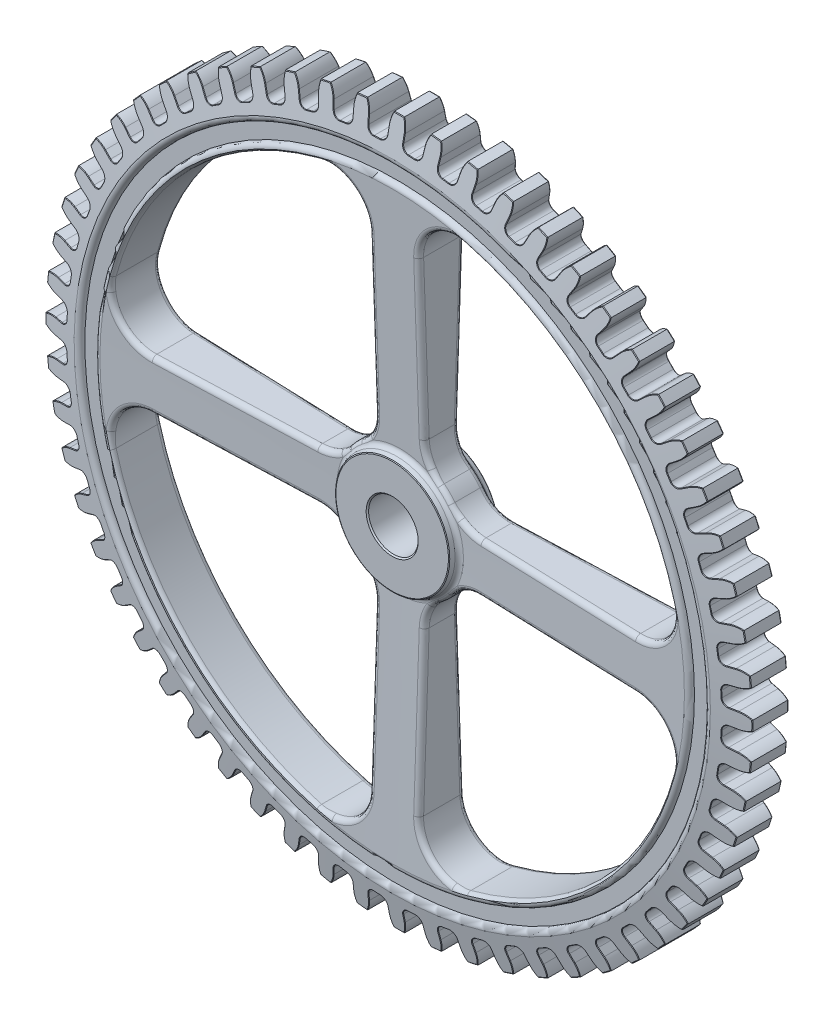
SolidWorks part; units mm, degrees
ref_plane "Спереди" through (0, 0, 0) normal (0, 0, 1) x (1, 0, 0)
ref_plane "Сверху" through (0, 0, 0) normal (0, 1, 0) x (1, 0, 0)
ref_plane "Справа" through (0, 0, 0) normal (1, 0, 0) x (0, 0, -1)
sketch "Эскиз2" plane through (0, 0, 0) normal (1, 0, 0) x (0, 0, -1)
  line L0 (-9.4803, 0) -> (8.8412, 0) construction
  line L1 (5, 5) -> (-5, 5)
  line L2 (5, 5) -> (5, 11.5)
  line L3 (3.6, 71.3) -> (-3.6, 71.3)
  line L4 (0, 0) -> (0, 71.3) construction
  line L5 (4, 63) -> (4, 60)
  line L6 (5, 11.5) -> (5, 38.75) construction
  line L7 (3.6, 71.3) -> (4.9816, 64.1908)
  line L8 (5, 11.5) -> (4.0932, 11.7772)
  line L9 (4.9994, 58.9651) -> (3.3862, 12.7684)
  line L10 (-5, 5) -> (-5, 11.5)
  line L11 (-5, 11.5) -> (-4.0932, 11.7772)
  line L12 (-4.9994, 58.9651) -> (-3.3862, 12.7684)
  line L13 (-4, 63) -> (-4, 60)
  line L14 (-3.6, 71.3) -> (-4.9816, 64.1908)
  arc A0 (4, 63) -> (4.9816, 64.1908) centre (4, 64) ccw
  arc A1 (4.9994, 58.9651) -> (4, 60) centre (4, 59) ccw
  arc A2 (3.3862, 12.7684) -> (4.0932, 11.7772) centre (4.3856, 12.7335) ccw
  arc A3 (-3.3862, 12.7684) -> (-4.0932, 11.7772) centre (-4.3856, 12.7335) cw
  arc A4 (-4.9994, 58.9651) -> (-4, 60) centre (-4, 59) cw
  arc A5 (-4, 63) -> (-4.9816, 64.1908) centre (-4, 64) cw
  point P19 (0, 5)
  dimension "D8" = 2
  dimension "D1" = 8.3
  dimension "D2" = 71.3
  dimension "D3" = 5
  dimension "D4" = 5
  dimension "D5" = 3.6
  dimension "D6" = 3
  dimension "D7" = 11.5
  dimension "D9" = 4
  dimension "D10" = 17
  dimension "D11" = 2
revolve "Повернуть1" add sketch "Эскиз2" angle 360 about L0
sketch "Эскиз4" plane through (0, 0, 0) normal (0, 0, 1) x (1, 0, 0)
  line L0 (0, 77.9843) -> (0, -81.6368) construction
  line L1 (-86.0797, 0) -> (81.9993, 0) construction
  line L2 (5, 48.7981) -> (5, 16.4924)
  line L3 (16.4924, 5) -> (48.7981, 5)
  line L4 (48.7981, -5) -> (16.4924, -5)
  line L5 (5, -16.4924) -> (5, -48.7981)
  line L6 (-5, -48.7981) -> (-5, -16.4924)
  line L7 (-16.4924, -5) -> (-48.7981, -5)
  line L8 (-48.7981, 5) -> (-16.4924, 5)
  line L9 (-5, 16.4924) -> (-5, 48.7981)
  arc A0 (10.2096, 8.0476) -> (8.0476, 10.2096) centre (0, 0) ccw
  arc A1 (56.5284, 15.0594) -> (15.0594, 56.5284) centre (0, 0) ccw
  arc A2 (15.0594, 56.5284) -> (5, 48.7981) centre (13, 48.7981) ccw
  arc A3 (48.7981, 5) -> (56.5284, 15.0594) centre (48.7981, 13) ccw
  arc A4 (5, 16.4924) -> (8.0476, 10.2096) centre (13, 16.4924) ccw
  arc A5 (10.2096, 8.0476) -> (16.4924, 5) centre (16.4924, 13) ccw
  arc A6 (8.0476, -10.2096) -> (10.2096, -8.0476) centre (0, 0) ccw
  arc A7 (15.0594, -56.5284) -> (56.5284, -15.0594) centre (0, 0) ccw
  arc A8 (56.5284, -15.0594) -> (48.7981, -5) centre (48.7981, -13) ccw
  arc A9 (5, -48.7981) -> (15.0594, -56.5284) centre (13, -48.7981) ccw
  arc A10 (16.4924, -5) -> (10.2096, -8.0476) centre (16.4924, -13) ccw
  arc A11 (8.0476, -10.2096) -> (5, -16.4924) centre (13, -16.4924) ccw
  arc A12 (-10.2096, -8.0476) -> (-8.0476, -10.2096) centre (0, 0) ccw
  arc A13 (-56.5284, -15.0594) -> (-15.0594, -56.5284) centre (0, 0) ccw
  arc A14 (-15.0594, -56.5284) -> (-5, -48.7981) centre (-13, -48.7981) ccw
  arc A15 (-48.7981, -5) -> (-56.5284, -15.0594) centre (-48.7981, -13) ccw
  arc A16 (-5, -16.4924) -> (-8.0476, -10.2096) centre (-13, -16.4924) ccw
  arc A17 (-10.2096, -8.0476) -> (-16.4924, -5) centre (-16.4924, -13) ccw
  arc A18 (-8.0476, 10.2096) -> (-10.2096, 8.0476) centre (0, 0) ccw
  arc A19 (-15.0594, 56.5284) -> (-56.5284, 15.0594) centre (0, 0) ccw
  arc A20 (-56.5284, 15.0594) -> (-48.7981, 5) centre (-48.7981, 13) ccw
  arc A21 (-5, 48.7981) -> (-15.0594, 56.5284) centre (-13, 48.7981) ccw
  arc A22 (-16.4924, 5) -> (-10.2096, 8.0476) centre (-16.4924, 13) ccw
  arc A23 (-8.0476, 10.2096) -> (-5, 16.4924) centre (-13, 16.4924) ccw
  dimension "D3" = 26
  dimension "D4" = 117
  dimension "D5" = 16
  dimension "D1" = 5
  dimension "D2" = 5
  dimension "D7" = 10
  dimension "D6" = 4
extrude "Вырез-Вытянуть1" cut sketch "Эскиз4" against normal mid plane 10
fillet "Скругление1" radius 1 56 edges at (12.2001, 6.249, -3.419) (9.1924, 9.1924, -3.3943) (5.4509, 13.8447, -3.4599) (7.5393, 54.6445, -4.8666) (55.5841, 8.7633, -4.9053) (54.6445, -7.5393, -4.8666) (8.7633, -55.5841, -4.9053) (6.249, -12.2001, -3.419) (9.1924, -9.1924, -3.3943) (13.8447, -5.4509, -3.4599) (-12.2001, -6.249, -3.419) (-9.1924, -9.1924, -3.3943) (-5.4509, -13.8447, -3.4599) (-7.5393, -54.6445, -4.8666) (-55.5841, -8.7633, -4.9053) (-54.6445, 7.5393, -4.8666) (-8.7633, 55.5841, -4.9053) (-6.249, 12.2001, -3.419) (-9.1924, 9.1924, -3.3943) (-13.8447, 5.4509, -3.4599) (7.5393, -54.6445, 4.8666) (55.5841, -8.7633, 4.9053) (12.2001, -6.249, 3.419) (9.1924, -9.1924, 3.3943) (5.4509, -13.8447, 3.4599) (-54.6445, -7.5393, 4.8666) (-8.7633, -55.5841, 4.9053) (-6.249, -12.2001, 3.419) (-9.1924, -9.1924, 3.3943) (-13.8447, -5.4509, 3.4599) (-7.5393, 54.6445, 4.8666) (-55.5841, 8.7633, 4.9053) (-12.2001, 6.249, 3.419) (-9.1924, 9.1924, 3.3943) (-5.4509, 13.8447, 3.4599) (6.249, 12.2001, 3.419) (9.1924, 9.1924, 3.3943) (13.8447, 5.4509, 3.4599) (54.6445, 7.5393, 4.8666) (8.7633, 55.5841, 4.9053)
sketch "Эскиз5" plane through (0, 0, 0) normal (0, 0, 1) x (1, 0, 0)
  line L0 (0, 93.6984) -> (0, 0) construction
  line L1 (0, 0) -> (3.6112, 68.9054) construction
  line L2 (-1.6, 68.9054) -> (-1.6, 67.3339)
  line L3 (1.6, 68.9054) -> (1.6, 67.3339)
  line L4 (5.6113, 68.6952) -> (5.4471, 67.1322)
  line L5 (8.7938, 68.3607) -> (8.6295, 66.7978)
  line L6 (12.7612, 67.7323) -> (12.4345, 66.1951)
  line L7 (15.8913, 67.067) -> (15.5645, 65.5298)
  line L8 (19.7713, 66.0274) -> (19.2856, 64.5327)
  line L9 (22.8146, 65.0385) -> (22.329, 63.5439)
  line L10 (26.5647, 63.599) -> (25.9255, 62.1633)
  line L11 (29.488, 62.2975) -> (28.8488, 60.8618)
  line L12 (33.0671, 60.4739) -> (32.2813, 59.1128)
  line L13 (35.8384, 58.8739) -> (35.0526, 57.5128)
  line L14 (39.2072, 56.6861) -> (38.2834, 55.4147)
  line L15 (41.796, 54.8052) -> (40.8723, 53.5338)
  line L16 (44.9177, 52.2773) -> (43.8661, 51.1094)
  line L17 (47.2958, 50.1361) -> (46.2442, 48.9682)
  line L18 (50.1361, 47.2958) -> (48.9682, 46.2442)
  line L19 (52.2773, 44.9177) -> (51.1094, 43.8661)
  line L20 (54.8052, 41.796) -> (53.5338, 40.8723)
  line L21 (56.6861, 39.2072) -> (55.4147, 38.2834)
  line L22 (58.8739, 35.8384) -> (57.5128, 35.0526)
  line L23 (60.4739, 33.0671) -> (59.1128, 32.2813)
  line L24 (62.2975, 29.488) -> (60.8618, 28.8488)
  line L25 (63.599, 26.5647) -> (62.1633, 25.9255)
  line L26 (65.0385, 22.8146) -> (63.5439, 22.329)
  line L27 (66.0274, 19.7713) -> (64.5327, 19.2856)
  line L28 (67.067, 15.8913) -> (65.5298, 15.5645)
  line L29 (67.7323, 12.7612) -> (66.1951, 12.4345)
  line L30 (68.3607, 8.7938) -> (66.7978, 8.6295)
  line L31 (68.6952, 5.6113) -> (67.1322, 5.4471)
  line L32 (68.9054, 1.6) -> (67.3339, 1.6)
  line L33 (68.9054, -1.6) -> (67.3339, -1.6)
  line L34 (68.6952, -5.6113) -> (67.1322, -5.4471)
  line L35 (68.3607, -8.7938) -> (66.7978, -8.6295)
  line L36 (67.7323, -12.7612) -> (66.1951, -12.4345)
  line L37 (67.067, -15.8913) -> (65.5298, -15.5645)
  line L38 (66.0274, -19.7713) -> (64.5327, -19.2856)
  line L39 (65.0385, -22.8146) -> (63.5439, -22.329)
  line L40 (63.599, -26.5647) -> (62.1633, -25.9255)
  line L41 (62.2975, -29.488) -> (60.8618, -28.8488)
  line L42 (60.4739, -33.0671) -> (59.1128, -32.2813)
  line L43 (58.8739, -35.8384) -> (57.5128, -35.0526)
  line L44 (56.6861, -39.2072) -> (55.4147, -38.2834)
  line L45 (54.8052, -41.796) -> (53.5338, -40.8723)
  line L46 (52.2773, -44.9177) -> (51.1094, -43.8661)
  line L47 (50.1361, -47.2958) -> (48.9682, -46.2442)
  line L48 (47.2958, -50.1361) -> (46.2442, -48.9682)
  line L49 (44.9177, -52.2773) -> (43.8661, -51.1094)
  line L50 (41.796, -54.8052) -> (40.8723, -53.5338)
  line L51 (39.2072, -56.6861) -> (38.2834, -55.4147)
  line L52 (35.8384, -58.8739) -> (35.0526, -57.5128)
  line L53 (33.0671, -60.4739) -> (32.2813, -59.1128)
  line L54 (29.488, -62.2975) -> (28.8488, -60.8618)
  line L55 (26.5647, -63.599) -> (25.9255, -62.1633)
  line L56 (22.8146, -65.0385) -> (22.329, -63.5439)
  line L57 (19.7713, -66.0274) -> (19.2856, -64.5327)
  line L58 (15.8913, -67.067) -> (15.5645, -65.5298)
  line L59 (12.7612, -67.7323) -> (12.4345, -66.1951)
  line L60 (8.7938, -68.3607) -> (8.6295, -66.7978)
  line L61 (5.6113, -68.6952) -> (5.4471, -67.1322)
  line L62 (1.6, -68.9054) -> (1.6, -67.3339)
  line L63 (-1.6, -68.9054) -> (-1.6, -67.3339)
  line L64 (-5.6113, -68.6952) -> (-5.4471, -67.1322)
  line L65 (-8.7938, -68.3607) -> (-8.6295, -66.7978)
  line L66 (-12.7612, -67.7323) -> (-12.4345, -66.1951)
  line L67 (-15.8913, -67.067) -> (-15.5645, -65.5298)
  line L68 (-19.7713, -66.0274) -> (-19.2856, -64.5327)
  line L69 (-22.8146, -65.0385) -> (-22.329, -63.5439)
  line L70 (-26.5647, -63.599) -> (-25.9255, -62.1633)
  line L71 (-29.488, -62.2975) -> (-28.8488, -60.8618)
  line L72 (-33.0671, -60.4739) -> (-32.2813, -59.1128)
  line L73 (-35.8384, -58.8739) -> (-35.0526, -57.5128)
  line L74 (-39.2072, -56.6861) -> (-38.2834, -55.4147)
  line L75 (-41.796, -54.8052) -> (-40.8723, -53.5338)
  line L76 (-44.9177, -52.2773) -> (-43.8661, -51.1094)
  line L77 (-47.2958, -50.1361) -> (-46.2442, -48.9682)
  line L78 (-50.1361, -47.2958) -> (-48.9682, -46.2442)
  line L79 (-52.2773, -44.9177) -> (-51.1094, -43.8661)
  line L80 (-54.8052, -41.796) -> (-53.5338, -40.8723)
  line L81 (-56.6861, -39.2072) -> (-55.4147, -38.2834)
  line L82 (-58.8739, -35.8384) -> (-57.5128, -35.0526)
  line L83 (-60.4739, -33.0671) -> (-59.1128, -32.2813)
  line L84 (-62.2975, -29.488) -> (-60.8618, -28.8488)
  line L85 (-63.599, -26.5647) -> (-62.1633, -25.9255)
  line L86 (-65.0385, -22.8146) -> (-63.5439, -22.329)
  line L87 (-66.0274, -19.7713) -> (-64.5327, -19.2856)
  line L88 (-67.067, -15.8913) -> (-65.5298, -15.5645)
  line L89 (-67.7323, -12.7612) -> (-66.1951, -12.4345)
  line L90 (-68.3607, -8.7938) -> (-66.7978, -8.6295)
  line L91 (-68.6952, -5.6113) -> (-67.1322, -5.4471)
  line L92 (-68.9054, -1.6) -> (-67.3339, -1.6)
  line L93 (-68.9054, 1.6) -> (-67.3339, 1.6)
  line L94 (-68.6952, 5.6113) -> (-67.1322, 5.4471)
  line L95 (-68.3607, 8.7938) -> (-66.7978, 8.6295)
  line L96 (-67.7323, 12.7612) -> (-66.1951, 12.4345)
  line L97 (-67.067, 15.8913) -> (-65.5298, 15.5645)
  line L98 (-66.0274, 19.7713) -> (-64.5327, 19.2856)
  line L99 (-65.0385, 22.8146) -> (-63.5439, 22.329)
  line L100 (-63.599, 26.5647) -> (-62.1633, 25.9255)
  line L101 (-62.2975, 29.488) -> (-60.8618, 28.8488)
  line L102 (-60.4739, 33.0671) -> (-59.1128, 32.2813)
  line L103 (-58.8739, 35.8384) -> (-57.5128, 35.0526)
  line L104 (-56.6861, 39.2072) -> (-55.4147, 38.2834)
  line L105 (-54.8052, 41.796) -> (-53.5338, 40.8723)
  line L106 (-52.2773, 44.9177) -> (-51.1094, 43.8661)
  line L107 (-50.1361, 47.2958) -> (-48.9682, 46.2442)
  line L108 (-47.2958, 50.1361) -> (-46.2442, 48.9682)
  line L109 (-44.9177, 52.2773) -> (-43.8661, 51.1094)
  line L110 (-41.796, 54.8052) -> (-40.8723, 53.5338)
  line L111 (-39.2072, 56.6861) -> (-38.2834, 55.4147)
  line L112 (-35.8384, 58.8739) -> (-35.0526, 57.5128)
  line L113 (-33.0671, 60.4739) -> (-32.2813, 59.1128)
  line L114 (-29.488, 62.2975) -> (-28.8488, 60.8618)
  line L115 (-26.5647, 63.599) -> (-25.9255, 62.1633)
  line L116 (-22.8146, 65.0385) -> (-22.329, 63.5439)
  line L117 (-19.7713, 66.0274) -> (-19.2856, 64.5327)
  line L118 (-15.8913, 67.067) -> (-15.5645, 65.5298)
  line L119 (-12.7612, 67.7323) -> (-12.4345, 66.1951)
  line L120 (-8.7938, 68.3607) -> (-8.6295, 66.7978)
  line L121 (-5.6113, 68.6952) -> (-5.4471, 67.1322)
  circle A0 centre (0, 0) radius 69 construction
  arc A1 (-9.7062, 65.4088) -> (-10.9813, 65.2068) centre (0, 0) ccw
  arc A2 (-1.021, 71.2927) -> (-1.6, 68.9054) centre (3.6112, 68.9054) ccw
  circle A3 centre (0, 0) radius 71.3 construction
  arc A4 (1.021, 71.2927) -> (-1.021, 71.2927) centre (0, 0) ccw
  arc A5 (1.021, 71.2927) -> (1.6, 68.9054) centre (-3.6112, 68.9054) cw
  arc A6 (6.4367, 71.0089) -> (5.6113, 68.6952) centre (10.794, 68.1505) ccw
  arc A7 (8.4676, 70.7954) -> (6.4367, 71.0089) centre (0, 0) ccw
  arc A8 (8.4676, 70.7954) -> (8.7938, 68.3607) centre (3.6112, 68.9054) cw
  arc A9 (13.8239, 69.9471) -> (12.7612, 67.7323) centre (17.8585, 66.6489) ccw
  arc A10 (15.8213, 69.5225) -> (13.8239, 69.9471) centre (0, 0) ccw
  arc A11 (15.8213, 69.5225) -> (15.8913, 67.067) centre (10.794, 68.1505) cw
  arc A12 (21.0596, 68.1189) -> (19.7713, 66.0274) centre (24.7274, 64.417) ccw
  arc A13 (23.0017, 67.4879) -> (21.0596, 68.1189) centre (0, 0) ccw
  arc A14 (23.0017, 67.4879) -> (22.8146, 65.0385) centre (17.8585, 66.6489) cw
  arc A15 (28.0646, 65.5444) -> (26.5647, 63.599) centre (31.3253, 61.4795) ccw
  arc A16 (29.9301, 64.7138) -> (28.0646, 65.5444) centre (0, 0) ccw
  arc A17 (29.9301, 64.7138) -> (29.488, 62.2975) centre (24.7274, 64.417) cw
  arc A18 (34.7621, 62.2518) -> (33.0671, 60.4739) centre (37.5801, 57.8683) ccw
  arc A19 (36.5306, 61.2308) -> (34.7621, 62.2518) centre (0, 0) ccw
  arc A20 (36.5306, 61.2308) -> (35.8384, 58.8739) centre (31.3253, 61.4795) cw
  arc A21 (41.0788, 58.2771) -> (39.2072, 56.6861) centre (43.4231, 53.6231) ccw
  arc A22 (42.7308, 57.0768) -> (41.0788, 58.2771) centre (0, 0) ccw
  arc A23 (42.7308, 57.0768) -> (41.796, 54.8052) centre (37.5801, 57.8683) cw
  arc A24 (46.9453, 53.664) -> (44.9177, 52.2773) centre (48.7904, 48.7904) ccw
  arc A25 (48.4629, 52.2976) -> (46.9453, 53.664) centre (0, 0) ccw
  arc A26 (48.4629, 52.2976) -> (47.2958, 50.1361) centre (43.4231, 53.6231) cw
  arc A27 (52.2976, 48.4629) -> (50.1361, 47.2958) centre (53.6231, 43.4231) ccw
  arc A28 (53.664, 46.9453) -> (52.2976, 48.4629) centre (0, 0) ccw
  arc A29 (53.664, 46.9453) -> (52.2773, 44.9177) centre (48.7904, 48.7904) cw
  arc A30 (57.0768, 42.7308) -> (54.8052, 41.796) centre (57.8683, 37.5801) ccw
  arc A31 (58.2771, 41.0788) -> (57.0768, 42.7308) centre (0, 0) ccw
  arc A32 (58.2771, 41.0788) -> (56.6861, 39.2072) centre (53.6231, 43.4231) cw
  arc A33 (61.2308, 36.5306) -> (58.8739, 35.8384) centre (61.4795, 31.3253) ccw
  arc A34 (62.2518, 34.7621) -> (61.2308, 36.5306) centre (0, 0) ccw
  arc A35 (62.2518, 34.7621) -> (60.4739, 33.0671) centre (57.8683, 37.5801) cw
  arc A36 (64.7138, 29.9301) -> (62.2975, 29.488) centre (64.417, 24.7274) ccw
  arc A37 (65.5444, 28.0646) -> (64.7138, 29.9301) centre (0, 0) ccw
  arc A38 (65.5444, 28.0646) -> (63.599, 26.5647) centre (61.4795, 31.3253) cw
  arc A39 (67.4879, 23.0017) -> (65.0385, 22.8146) centre (66.6489, 17.8585) ccw
  arc A40 (68.1189, 21.0596) -> (67.4879, 23.0017) centre (0, 0) ccw
  arc A41 (68.1189, 21.0596) -> (66.0274, 19.7713) centre (64.417, 24.7274) cw
  arc A42 (69.5225, 15.8213) -> (67.067, 15.8913) centre (68.1505, 10.794) ccw
  arc A43 (69.9471, 13.8239) -> (69.5225, 15.8213) centre (0, 0) ccw
  arc A44 (69.9471, 13.8239) -> (67.7323, 12.7612) centre (66.6489, 17.8585) cw
  arc A45 (70.7954, 8.4676) -> (68.3607, 8.7938) centre (68.9054, 3.6112) ccw
  arc A46 (71.0089, 6.4367) -> (70.7954, 8.4676) centre (0, 0) ccw
  arc A47 (71.0089, 6.4367) -> (68.6952, 5.6113) centre (68.1505, 10.794) cw
  arc A48 (71.2927, 1.021) -> (68.9054, 1.6) centre (68.9054, -3.6112) ccw
  arc A49 (71.2927, -1.021) -> (71.2927, 1.021) centre (0, 0) ccw
  arc A50 (71.2927, -1.021) -> (68.9054, -1.6) centre (68.9054, 3.6112) cw
  arc A51 (71.0089, -6.4367) -> (68.6952, -5.6113) centre (68.1505, -10.794) ccw
  arc A52 (70.7954, -8.4676) -> (71.0089, -6.4367) centre (0, 0) ccw
  arc A53 (70.7954, -8.4676) -> (68.3607, -8.7938) centre (68.9054, -3.6112) cw
  arc A54 (69.9471, -13.8239) -> (67.7323, -12.7612) centre (66.6489, -17.8585) ccw
  arc A55 (69.5225, -15.8213) -> (69.9471, -13.8239) centre (0, 0) ccw
  arc A56 (69.5225, -15.8213) -> (67.067, -15.8913) centre (68.1505, -10.794) cw
  arc A57 (68.1189, -21.0596) -> (66.0274, -19.7713) centre (64.417, -24.7274) ccw
  arc A58 (67.4879, -23.0017) -> (68.1189, -21.0596) centre (0, 0) ccw
  arc A59 (67.4879, -23.0017) -> (65.0385, -22.8146) centre (66.6489, -17.8585) cw
  arc A60 (65.5444, -28.0646) -> (63.599, -26.5647) centre (61.4795, -31.3253) ccw
  arc A61 (64.7138, -29.9301) -> (65.5444, -28.0646) centre (0, 0) ccw
  arc A62 (64.7138, -29.9301) -> (62.2975, -29.488) centre (64.417, -24.7274) cw
  arc A63 (62.2518, -34.7621) -> (60.4739, -33.0671) centre (57.8683, -37.5801) ccw
  arc A64 (61.2308, -36.5306) -> (62.2518, -34.7621) centre (0, 0) ccw
  arc A65 (61.2308, -36.5306) -> (58.8739, -35.8384) centre (61.4795, -31.3253) cw
  arc A66 (58.2771, -41.0788) -> (56.6861, -39.2072) centre (53.6231, -43.4231) ccw
  arc A67 (57.0768, -42.7308) -> (58.2771, -41.0788) centre (0, 0) ccw
  arc A68 (57.0768, -42.7308) -> (54.8052, -41.796) centre (57.8683, -37.5801) cw
  arc A69 (53.664, -46.9453) -> (52.2773, -44.9177) centre (48.7904, -48.7904) ccw
  arc A70 (52.2976, -48.4629) -> (53.664, -46.9453) centre (0, 0) ccw
  arc A71 (52.2976, -48.4629) -> (50.1361, -47.2958) centre (53.6231, -43.4231) cw
  arc A72 (48.4629, -52.2976) -> (47.2958, -50.1361) centre (43.4231, -53.6231) ccw
  arc A73 (46.9453, -53.664) -> (48.4629, -52.2976) centre (0, 0) ccw
  arc A74 (46.9453, -53.664) -> (44.9177, -52.2773) centre (48.7904, -48.7904) cw
  arc A75 (42.7308, -57.0768) -> (41.796, -54.8052) centre (37.5801, -57.8683) ccw
  arc A76 (41.0788, -58.2771) -> (42.7308, -57.0768) centre (0, 0) ccw
  arc A77 (41.0788, -58.2771) -> (39.2072, -56.6861) centre (43.4231, -53.6231) cw
  arc A78 (36.5306, -61.2308) -> (35.8384, -58.8739) centre (31.3253, -61.4795) ccw
  arc A79 (34.7621, -62.2518) -> (36.5306, -61.2308) centre (0, 0) ccw
  arc A80 (34.7621, -62.2518) -> (33.0671, -60.4739) centre (37.5801, -57.8683) cw
  arc A81 (29.9301, -64.7138) -> (29.488, -62.2975) centre (24.7274, -64.417) ccw
  arc A82 (28.0646, -65.5444) -> (29.9301, -64.7138) centre (0, 0) ccw
  arc A83 (28.0646, -65.5444) -> (26.5647, -63.599) centre (31.3253, -61.4795) cw
  arc A84 (23.0017, -67.4879) -> (22.8146, -65.0385) centre (17.8585, -66.6489) ccw
  arc A85 (21.0596, -68.1189) -> (23.0017, -67.4879) centre (0, 0) ccw
  arc A86 (21.0596, -68.1189) -> (19.7713, -66.0274) centre (24.7274, -64.417) cw
  arc A87 (15.8213, -69.5225) -> (15.8913, -67.067) centre (10.794, -68.1505) ccw
  arc A88 (13.8239, -69.9471) -> (15.8213, -69.5225) centre (0, 0) ccw
  arc A89 (13.8239, -69.9471) -> (12.7612, -67.7323) centre (17.8585, -66.6489) cw
  arc A90 (8.4676, -70.7954) -> (8.7938, -68.3607) centre (3.6112, -68.9054) ccw
  arc A91 (6.4367, -71.0089) -> (8.4676, -70.7954) centre (0, 0) ccw
  arc A92 (6.4367, -71.0089) -> (5.6113, -68.6952) centre (10.794, -68.1505) cw
  arc A93 (1.021, -71.2927) -> (1.6, -68.9054) centre (-3.6112, -68.9054) ccw
  arc A94 (-1.021, -71.2927) -> (1.021, -71.2927) centre (0, 0) ccw
  arc A95 (-1.021, -71.2927) -> (-1.6, -68.9054) centre (3.6112, -68.9054) cw
  arc A96 (-6.4367, -71.0089) -> (-5.6113, -68.6952) centre (-10.794, -68.1505) ccw
  arc A97 (-8.4676, -70.7954) -> (-6.4367, -71.0089) centre (0, 0) ccw
  arc A98 (-8.4676, -70.7954) -> (-8.7938, -68.3607) centre (-3.6112, -68.9054) cw
  arc A99 (-13.8239, -69.9471) -> (-12.7612, -67.7323) centre (-17.8585, -66.6489) ccw
  arc A100 (-15.8213, -69.5225) -> (-13.8239, -69.9471) centre (0, 0) ccw
  arc A101 (-15.8213, -69.5225) -> (-15.8913, -67.067) centre (-10.794, -68.1505) cw
  arc A102 (-21.0596, -68.1189) -> (-19.7713, -66.0274) centre (-24.7274, -64.417) ccw
  arc A103 (-23.0017, -67.4879) -> (-21.0596, -68.1189) centre (0, 0) ccw
  arc A104 (-23.0017, -67.4879) -> (-22.8146, -65.0385) centre (-17.8585, -66.6489) cw
  arc A105 (-28.0646, -65.5444) -> (-26.5647, -63.599) centre (-31.3253, -61.4795) ccw
  arc A106 (-29.9301, -64.7138) -> (-28.0646, -65.5444) centre (0, 0) ccw
  arc A107 (-29.9301, -64.7138) -> (-29.488, -62.2975) centre (-24.7274, -64.417) cw
  arc A108 (-34.7621, -62.2518) -> (-33.0671, -60.4739) centre (-37.5801, -57.8683) ccw
  arc A109 (-36.5306, -61.2308) -> (-34.7621, -62.2518) centre (0, 0) ccw
  arc A110 (-36.5306, -61.2308) -> (-35.8384, -58.8739) centre (-31.3253, -61.4795) cw
  arc A111 (-41.0788, -58.2771) -> (-39.2072, -56.6861) centre (-43.4231, -53.6231) ccw
  arc A112 (-42.7308, -57.0768) -> (-41.0788, -58.2771) centre (0, 0) ccw
  arc A113 (-42.7308, -57.0768) -> (-41.796, -54.8052) centre (-37.5801, -57.8683) cw
  arc A114 (-46.9453, -53.664) -> (-44.9177, -52.2773) centre (-48.7904, -48.7904) ccw
  arc A115 (-48.4629, -52.2976) -> (-46.9453, -53.664) centre (0, 0) ccw
  arc A116 (-48.4629, -52.2976) -> (-47.2958, -50.1361) centre (-43.4231, -53.6231) cw
  arc A117 (-52.2976, -48.4629) -> (-50.1361, -47.2958) centre (-53.6231, -43.4231) ccw
  arc A118 (-53.664, -46.9453) -> (-52.2976, -48.4629) centre (0, 0) ccw
  arc A119 (-53.664, -46.9453) -> (-52.2773, -44.9177) centre (-48.7904, -48.7904) cw
  arc A120 (-57.0768, -42.7308) -> (-54.8052, -41.796) centre (-57.8683, -37.5801) ccw
  arc A121 (-58.2771, -41.0788) -> (-57.0768, -42.7308) centre (0, 0) ccw
  arc A122 (-58.2771, -41.0788) -> (-56.6861, -39.2072) centre (-53.6231, -43.4231) cw
  arc A123 (-61.2308, -36.5306) -> (-58.8739, -35.8384) centre (-61.4795, -31.3253) ccw
  arc A124 (-62.2518, -34.7621) -> (-61.2308, -36.5306) centre (0, 0) ccw
  arc A125 (-62.2518, -34.7621) -> (-60.4739, -33.0671) centre (-57.8683, -37.5801) cw
  arc A126 (-64.7138, -29.9301) -> (-62.2975, -29.488) centre (-64.417, -24.7274) ccw
  arc A127 (-65.5444, -28.0646) -> (-64.7138, -29.9301) centre (0, 0) ccw
  arc A128 (-65.5444, -28.0646) -> (-63.599, -26.5647) centre (-61.4795, -31.3253) cw
  arc A129 (-67.4879, -23.0017) -> (-65.0385, -22.8146) centre (-66.6489, -17.8585) ccw
  arc A130 (-68.1189, -21.0596) -> (-67.4879, -23.0017) centre (0, 0) ccw
  arc A131 (-68.1189, -21.0596) -> (-66.0274, -19.7713) centre (-64.417, -24.7274) cw
  arc A132 (-69.5225, -15.8213) -> (-67.067, -15.8913) centre (-68.1505, -10.794) ccw
  arc A133 (-69.9471, -13.8239) -> (-69.5225, -15.8213) centre (0, 0) ccw
  arc A134 (-69.9471, -13.8239) -> (-67.7323, -12.7612) centre (-66.6489, -17.8585) cw
  arc A135 (-70.7954, -8.4676) -> (-68.3607, -8.7938) centre (-68.9054, -3.6112) ccw
  arc A136 (-71.0089, -6.4367) -> (-70.7954, -8.4676) centre (0, 0) ccw
  arc A137 (-71.0089, -6.4367) -> (-68.6952, -5.6113) centre (-68.1505, -10.794) cw
  arc A138 (-71.2927, -1.021) -> (-68.9054, -1.6) centre (-68.9054, 3.6112) ccw
  arc A139 (-71.2927, 1.021) -> (-71.2927, -1.021) centre (0, 0) ccw
  arc A140 (-71.2927, 1.021) -> (-68.9054, 1.6) centre (-68.9054, -3.6112) cw
  arc A141 (-71.0089, 6.4367) -> (-68.6952, 5.6113) centre (-68.1505, 10.794) ccw
  arc A142 (-70.7954, 8.4676) -> (-71.0089, 6.4367) centre (0, 0) ccw
  arc A143 (-70.7954, 8.4676) -> (-68.3607, 8.7938) centre (-68.9054, 3.6112) cw
  arc A144 (-69.9471, 13.8239) -> (-67.7323, 12.7612) centre (-66.6489, 17.8585) ccw
  arc A145 (-69.5225, 15.8213) -> (-69.9471, 13.8239) centre (0, 0) ccw
  arc A146 (-69.5225, 15.8213) -> (-67.067, 15.8913) centre (-68.1505, 10.794) cw
  arc A147 (-68.1189, 21.0596) -> (-66.0274, 19.7713) centre (-64.417, 24.7274) ccw
  arc A148 (-67.4879, 23.0017) -> (-68.1189, 21.0596) centre (0, 0) ccw
  arc A149 (-67.4879, 23.0017) -> (-65.0385, 22.8146) centre (-66.6489, 17.8585) cw
  arc A150 (-65.5444, 28.0646) -> (-63.599, 26.5647) centre (-61.4795, 31.3253) ccw
  arc A151 (-64.7138, 29.9301) -> (-65.5444, 28.0646) centre (0, 0) ccw
  arc A152 (-64.7138, 29.9301) -> (-62.2975, 29.488) centre (-64.417, 24.7274) cw
  arc A153 (-62.2518, 34.7621) -> (-60.4739, 33.0671) centre (-57.8683, 37.5801) ccw
  arc A154 (-61.2308, 36.5306) -> (-62.2518, 34.7621) centre (0, 0) ccw
  arc A155 (-61.2308, 36.5306) -> (-58.8739, 35.8384) centre (-61.4795, 31.3253) cw
  arc A156 (-58.2771, 41.0788) -> (-56.6861, 39.2072) centre (-53.6231, 43.4231) ccw
  arc A157 (-57.0768, 42.7308) -> (-58.2771, 41.0788) centre (0, 0) ccw
  arc A158 (-57.0768, 42.7308) -> (-54.8052, 41.796) centre (-57.8683, 37.5801) cw
  arc A159 (-53.664, 46.9453) -> (-52.2773, 44.9177) centre (-48.7904, 48.7904) ccw
  arc A160 (-52.2976, 48.4629) -> (-53.664, 46.9453) centre (0, 0) ccw
  arc A161 (-52.2976, 48.4629) -> (-50.1361, 47.2958) centre (-53.6231, 43.4231) cw
  arc A162 (-48.4629, 52.2976) -> (-47.2958, 50.1361) centre (-43.4231, 53.6231) ccw
  arc A163 (-46.9453, 53.664) -> (-48.4629, 52.2976) centre (0, 0) ccw
  arc A164 (-46.9453, 53.664) -> (-44.9177, 52.2773) centre (-48.7904, 48.7904) cw
  arc A165 (-42.7308, 57.0768) -> (-41.796, 54.8052) centre (-37.5801, 57.8683) ccw
  arc A166 (-41.0788, 58.2771) -> (-42.7308, 57.0768) centre (0, 0) ccw
  arc A167 (-41.0788, 58.2771) -> (-39.2072, 56.6861) centre (-43.4231, 53.6231) cw
  arc A168 (-36.5306, 61.2308) -> (-35.8384, 58.8739) centre (-31.3253, 61.4795) ccw
  arc A169 (-34.7621, 62.2518) -> (-36.5306, 61.2308) centre (0, 0) ccw
  arc A170 (-34.7621, 62.2518) -> (-33.0671, 60.4739) centre (-37.5801, 57.8683) cw
  arc A171 (-29.9301, 64.7138) -> (-29.488, 62.2975) centre (-24.7274, 64.417) ccw
  arc A172 (-28.0646, 65.5444) -> (-29.9301, 64.7138) centre (0, 0) ccw
  arc A173 (-28.0646, 65.5444) -> (-26.5647, 63.599) centre (-31.3253, 61.4795) cw
  arc A174 (-23.0017, 67.4879) -> (-22.8146, 65.0385) centre (-17.8585, 66.6489) ccw
  arc A175 (-21.0596, 68.1189) -> (-23.0017, 67.4879) centre (0, 0) ccw
  arc A176 (-21.0596, 68.1189) -> (-19.7713, 66.0274) centre (-24.7274, 64.417) cw
  arc A177 (-15.8213, 69.5225) -> (-15.8913, 67.067) centre (-10.794, 68.1505) ccw
  arc A178 (-13.8239, 69.9471) -> (-15.8213, 69.5225) centre (0, 0) ccw
  arc A179 (-13.8239, 69.9471) -> (-12.7612, 67.7323) centre (-17.8585, 66.6489) cw
  arc A180 (-8.4676, 70.7954) -> (-8.7938, 68.3607) centre (-3.6112, 68.9054) ccw
  arc A181 (-6.4367, 71.0089) -> (-8.4676, 70.7954) centre (0, 0) ccw
  arc A182 (-6.4367, 71.0089) -> (-5.6113, 68.6952) centre (-10.794, 68.1505) cw
  arc A183 (-2.8159, 66.065) -> (-4.1052, 65.9974) centre (0, 0) ccw
  arc A184 (4.1052, 65.9974) -> (2.8159, 66.065) centre (0, 0) ccw
  arc A185 (-16.4901, 64.0359) -> (-17.7371, 63.7017) centre (0, 0) ccw
  arc A186 (-23.0933, 61.9614) -> (-24.2986, 61.4987) centre (0, 0) ccw
  arc A187 (-29.4435, 59.2081) -> (-30.5939, 58.6219) centre (0, 0) ccw
  arc A188 (-35.4712, 55.806) -> (-36.5539, 55.1029) centre (0, 0) ccw
  arc A189 (10.9813, 65.2068) -> (9.7062, 65.4088) centre (0, 0) ccw
  arc A190 (17.7371, 63.7017) -> (16.4901, 64.0359) centre (0, 0) ccw
  arc A191 (24.2986, 61.4987) -> (23.0933, 61.9614) centre (0, 0) ccw
  arc A192 (30.5939, 58.6219) -> (29.4435, 59.2081) centre (0, 0) ccw
  arc A193 (36.5539, 55.1029) -> (35.4712, 55.806) centre (0, 0) ccw
  arc A194 (42.1135, 50.9801) -> (41.1102, 51.7926) centre (0, 0) ccw
  arc A195 (47.2117, 46.2988) -> (46.2988, 47.2117) centre (0, 0) ccw
  arc A196 (51.7926, 41.1102) -> (50.9801, 42.1135) centre (0, 0) ccw
  arc A197 (55.806, 35.4712) -> (55.1029, 36.5539) centre (0, 0) ccw
  arc A198 (59.2081, 29.4435) -> (58.6219, 30.5939) centre (0, 0) ccw
  arc A199 (61.9614, 23.0933) -> (61.4987, 24.2986) centre (0, 0) ccw
  arc A200 (64.0359, 16.4901) -> (63.7017, 17.7371) centre (0, 0) ccw
  arc A201 (65.4088, 9.7062) -> (65.2068, 10.9813) centre (0, 0) ccw
  arc A202 (66.065, 2.8159) -> (65.9974, 4.1052) centre (0, 0) ccw
  arc A203 (65.9974, -4.1052) -> (66.065, -2.8159) centre (0, 0) ccw
  arc A204 (65.2068, -10.9813) -> (65.4088, -9.7062) centre (0, 0) ccw
  arc A205 (63.7017, -17.7371) -> (64.0359, -16.4901) centre (0, 0) ccw
  arc A206 (61.4987, -24.2986) -> (61.9614, -23.0933) centre (0, 0) ccw
  arc A207 (58.6219, -30.5939) -> (59.2081, -29.4435) centre (0, 0) ccw
  arc A208 (55.1029, -36.5539) -> (55.806, -35.4712) centre (0, 0) ccw
  arc A209 (50.9801, -42.1135) -> (51.7926, -41.1102) centre (0, 0) ccw
  arc A210 (46.2988, -47.2117) -> (47.2117, -46.2988) centre (0, 0) ccw
  arc A211 (41.1102, -51.7926) -> (42.1135, -50.9801) centre (0, 0) ccw
  arc A212 (35.4712, -55.806) -> (36.5539, -55.1029) centre (0, 0) ccw
  arc A213 (29.4435, -59.2081) -> (30.5939, -58.6219) centre (0, 0) ccw
  arc A214 (23.0933, -61.9614) -> (24.2986, -61.4987) centre (0, 0) ccw
  arc A215 (16.4901, -64.0359) -> (17.7371, -63.7017) centre (0, 0) ccw
  arc A216 (9.7062, -65.4088) -> (10.9813, -65.2068) centre (0, 0) ccw
  arc A217 (2.8159, -66.065) -> (4.1052, -65.9974) centre (0, 0) ccw
  arc A218 (-4.1052, -65.9974) -> (-2.8159, -66.065) centre (0, 0) ccw
  arc A219 (-10.9813, -65.2068) -> (-9.7062, -65.4088) centre (0, 0) ccw
  arc A220 (-17.7371, -63.7017) -> (-16.4901, -64.0359) centre (0, 0) ccw
  arc A221 (-24.2986, -61.4987) -> (-23.0933, -61.9614) centre (0, 0) ccw
  arc A222 (-30.5939, -58.6219) -> (-29.4435, -59.2081) centre (0, 0) ccw
  arc A223 (-36.5539, -55.1029) -> (-35.4712, -55.806) centre (0, 0) ccw
  arc A224 (-42.1135, -50.9801) -> (-41.1102, -51.7926) centre (0, 0) ccw
  arc A225 (-47.2117, -46.2988) -> (-46.2988, -47.2117) centre (0, 0) ccw
  arc A226 (-51.7926, -41.1102) -> (-50.9801, -42.1135) centre (0, 0) ccw
  arc A227 (-55.806, -35.4712) -> (-55.1029, -36.5539) centre (0, 0) ccw
  arc A228 (-59.2081, -29.4435) -> (-58.6219, -30.5939) centre (0, 0) ccw
  arc A229 (-61.9614, -23.0933) -> (-61.4987, -24.2986) centre (0, 0) ccw
  arc A230 (-64.0359, -16.4901) -> (-63.7017, -17.7371) centre (0, 0) ccw
  arc A231 (-65.4088, -9.7062) -> (-65.2068, -10.9813) centre (0, 0) ccw
  arc A232 (-66.065, -2.8159) -> (-65.9974, -4.1052) centre (0, 0) ccw
  arc A233 (-65.9974, 4.1052) -> (-66.065, 2.8159) centre (0, 0) ccw
  arc A234 (-65.2068, 10.9813) -> (-65.4088, 9.7062) centre (0, 0) ccw
  arc A235 (-63.7017, 17.7371) -> (-64.0359, 16.4901) centre (0, 0) ccw
  arc A236 (-61.4987, 24.2986) -> (-61.9614, 23.0933) centre (0, 0) ccw
  arc A237 (-58.6219, 30.5939) -> (-59.2081, 29.4435) centre (0, 0) ccw
  arc A238 (-55.1029, 36.5539) -> (-55.806, 35.4712) centre (0, 0) ccw
  arc A239 (-50.9801, 42.1135) -> (-51.7926, 41.1102) centre (0, 0) ccw
  arc A240 (-46.2988, 47.2117) -> (-47.2117, 46.2988) centre (0, 0) ccw
  arc A241 (-41.1102, 51.7926) -> (-42.1135, 50.9801) centre (0, 0) ccw
  arc A242 (15.5645, 65.5298) -> (16.4901, 64.0359) centre (16.8068, 65.2658) ccw
  arc A243 (19.2856, 64.5327) -> (17.7371, 63.7017) centre (18.0778, 64.9252) cw
  arc A244 (22.329, 63.5439) -> (23.0933, 61.9614) centre (23.5368, 63.1514) ccw
  arc A245 (25.9255, 62.1633) -> (24.2986, 61.4987) centre (24.7653, 62.6799) cw
  arc A246 (28.8488, 60.8618) -> (29.4435, 59.2081) centre (30.009, 60.3452) ccw
  arc A247 (32.2813, 59.1128) -> (30.5939, 58.6219) centre (31.1814, 59.7478) cw
  arc A248 (35.0526, 57.5128) -> (35.4712, 55.806) centre (36.1524, 56.8778) ccw
  arc A249 (38.2834, 55.4147) -> (36.5539, 55.1029) centre (37.256, 56.1612) cw
  arc A250 (40.8723, 53.5338) -> (41.1102, 51.7926) centre (41.8997, 52.7873) ccw
  arc A251 (43.8661, 51.1094) -> (42.1135, 50.9801) centre (42.9223, 51.9592) cw
  arc A252 (46.2442, 48.9682) -> (46.2988, 47.2117) centre (47.188, 48.1184) ccw
  arc A253 (48.9682, 46.2442) -> (47.2117, 46.2988) centre (48.1184, 47.188) cw
  arc A254 (51.1094, 43.8661) -> (50.9801, 42.1135) centre (51.9592, 42.9223) ccw
  arc A255 (53.5338, 40.8723) -> (51.7926, 41.1102) centre (52.7873, 41.8997) cw
  arc A256 (55.4147, 38.2834) -> (55.1029, 36.5539) centre (56.1612, 37.256) ccw
  arc A257 (57.5128, 35.0526) -> (55.806, 35.4712) centre (56.8778, 36.1524) cw
  arc A258 (59.1128, 32.2813) -> (58.6219, 30.5939) centre (59.7478, 31.1814) ccw
  arc A259 (60.8618, 28.8488) -> (59.2081, 29.4435) centre (60.3452, 30.009) cw
  arc A260 (62.1633, 25.9255) -> (61.4987, 24.2986) centre (62.6799, 24.7653) ccw
  arc A261 (63.5439, 22.329) -> (61.9614, 23.0933) centre (63.1514, 23.5368) cw
  arc A262 (64.5327, 19.2856) -> (63.7017, 17.7371) centre (64.9252, 18.0778) ccw
  arc A263 (65.5298, 15.5645) -> (64.0359, 16.4901) centre (65.2658, 16.8068) cw
  arc A264 (66.1951, 12.4345) -> (65.2068, 10.9813) centre (66.4592, 11.1922) ccw
  arc A265 (66.7978, 8.6295) -> (65.4088, 9.7062) centre (66.665, 9.8926) cw
  arc A266 (67.1322, 5.4471) -> (65.9974, 4.1052) centre (67.265, 4.184) ccw
  arc A267 (67.3339, 1.6) -> (66.065, 2.8159) centre (67.3339, 2.87) cw
  arc A268 (67.3339, -1.6) -> (66.065, -2.8159) centre (67.3339, -2.87) ccw
  arc A269 (67.1322, -5.4471) -> (65.9974, -4.1052) centre (67.265, -4.184) cw
  arc A270 (66.7978, -8.6295) -> (65.4088, -9.7062) centre (66.665, -9.8926) ccw
  arc A271 (66.1951, -12.4345) -> (65.2068, -10.9813) centre (66.4592, -11.1922) cw
  arc A272 (65.5298, -15.5645) -> (64.0359, -16.4901) centre (65.2658, -16.8068) ccw
  arc A273 (64.5327, -19.2856) -> (63.7017, -17.7371) centre (64.9252, -18.0778) cw
  arc A274 (63.5439, -22.329) -> (61.9614, -23.0933) centre (63.1514, -23.5368) ccw
  arc A275 (62.1633, -25.9255) -> (61.4987, -24.2986) centre (62.6799, -24.7653) cw
  arc A276 (60.8618, -28.8488) -> (59.2081, -29.4435) centre (60.3452, -30.009) ccw
  arc A277 (59.1128, -32.2813) -> (58.6219, -30.5939) centre (59.7478, -31.1814) cw
  arc A278 (57.5128, -35.0526) -> (55.806, -35.4712) centre (56.8778, -36.1524) ccw
  arc A279 (55.4147, -38.2834) -> (55.1029, -36.5539) centre (56.1612, -37.256) cw
  arc A280 (53.5338, -40.8723) -> (51.7926, -41.1102) centre (52.7873, -41.8997) ccw
  arc A281 (51.1094, -43.8661) -> (50.9801, -42.1135) centre (51.9592, -42.9223) cw
  arc A282 (48.9682, -46.2442) -> (47.2117, -46.2988) centre (48.1184, -47.188) ccw
  arc A283 (46.2442, -48.9682) -> (46.2988, -47.2117) centre (47.188, -48.1184) cw
  arc A284 (43.8661, -51.1094) -> (42.1135, -50.9801) centre (42.9223, -51.9592) ccw
  arc A285 (40.8723, -53.5338) -> (41.1102, -51.7926) centre (41.8997, -52.7873) cw
  arc A286 (38.2834, -55.4147) -> (36.5539, -55.1029) centre (37.256, -56.1612) ccw
  arc A287 (35.0526, -57.5128) -> (35.4712, -55.806) centre (36.1524, -56.8778) cw
  arc A288 (32.2813, -59.1128) -> (30.5939, -58.6219) centre (31.1814, -59.7478) ccw
  arc A289 (28.8488, -60.8618) -> (29.4435, -59.2081) centre (30.009, -60.3452) cw
  arc A290 (25.9255, -62.1633) -> (24.2986, -61.4987) centre (24.7653, -62.6799) ccw
  arc A291 (22.329, -63.5439) -> (23.0933, -61.9614) centre (23.5368, -63.1514) cw
  arc A292 (19.2856, -64.5327) -> (17.7371, -63.7017) centre (18.0778, -64.9252) ccw
  arc A293 (15.5645, -65.5298) -> (16.4901, -64.0359) centre (16.8068, -65.2658) cw
  arc A294 (12.4345, -66.1951) -> (10.9813, -65.2068) centre (11.1922, -66.4592) ccw
  arc A295 (8.6295, -66.7978) -> (9.7062, -65.4088) centre (9.8926, -66.665) cw
  arc A296 (5.4471, -67.1322) -> (4.1052, -65.9974) centre (4.184, -67.265) ccw
  arc A297 (1.6, -67.3339) -> (2.8159, -66.065) centre (2.87, -67.3339) cw
  arc A298 (-1.6, -67.3339) -> (-2.8159, -66.065) centre (-2.87, -67.3339) ccw
  arc A299 (-5.4471, -67.1322) -> (-4.1052, -65.9974) centre (-4.184, -67.265) cw
  arc A300 (-8.6295, -66.7978) -> (-9.7062, -65.4088) centre (-9.8926, -66.665) ccw
  arc A301 (-12.4345, -66.1951) -> (-10.9813, -65.2068) centre (-11.1922, -66.4592) cw
  arc A302 (-15.5645, -65.5298) -> (-16.4901, -64.0359) centre (-16.8068, -65.2658) ccw
  arc A303 (-19.2856, -64.5327) -> (-17.7371, -63.7017) centre (-18.0778, -64.9252) cw
  arc A304 (-22.329, -63.5439) -> (-23.0933, -61.9614) centre (-23.5368, -63.1514) ccw
  arc A305 (-25.9255, -62.1633) -> (-24.2986, -61.4987) centre (-24.7653, -62.6799) cw
  arc A306 (-28.8488, -60.8618) -> (-29.4435, -59.2081) centre (-30.009, -60.3452) ccw
  arc A307 (-32.2813, -59.1128) -> (-30.5939, -58.6219) centre (-31.1814, -59.7478) cw
  arc A308 (-35.0526, -57.5128) -> (-35.4712, -55.806) centre (-36.1524, -56.8778) ccw
  arc A309 (-38.2834, -55.4147) -> (-36.5539, -55.1029) centre (-37.256, -56.1612) cw
  arc A310 (-40.8723, -53.5338) -> (-41.1102, -51.7926) centre (-41.8997, -52.7873) ccw
  arc A311 (-43.8661, -51.1094) -> (-42.1135, -50.9801) centre (-42.9223, -51.9592) cw
  arc A312 (-46.2442, -48.9682) -> (-46.2988, -47.2117) centre (-47.188, -48.1184) ccw
  arc A313 (-48.9682, -46.2442) -> (-47.2117, -46.2988) centre (-48.1184, -47.188) cw
  arc A314 (-51.1094, -43.8661) -> (-50.9801, -42.1135) centre (-51.9592, -42.9223) ccw
  arc A315 (-53.5338, -40.8723) -> (-51.7926, -41.1102) centre (-52.7873, -41.8997) cw
  arc A316 (-55.4147, -38.2834) -> (-55.1029, -36.5539) centre (-56.1612, -37.256) ccw
  arc A317 (-57.5128, -35.0526) -> (-55.806, -35.4712) centre (-56.8778, -36.1524) cw
  arc A318 (-59.1128, -32.2813) -> (-58.6219, -30.5939) centre (-59.7478, -31.1814) ccw
  arc A319 (-60.8618, -28.8488) -> (-59.2081, -29.4435) centre (-60.3452, -30.009) cw
  arc A320 (-62.1633, -25.9255) -> (-61.4987, -24.2986) centre (-62.6799, -24.7653) ccw
  arc A321 (-63.5439, -22.329) -> (-61.9614, -23.0933) centre (-63.1514, -23.5368) cw
  arc A322 (-64.5327, -19.2856) -> (-63.7017, -17.7371) centre (-64.9252, -18.0778) ccw
  arc A323 (-65.5298, -15.5645) -> (-64.0359, -16.4901) centre (-65.2658, -16.8068) cw
  arc A324 (-66.1951, -12.4345) -> (-65.2068, -10.9813) centre (-66.4592, -11.1922) ccw
  arc A325 (-66.7978, -8.6295) -> (-65.4088, -9.7062) centre (-66.665, -9.8926) cw
  arc A326 (-67.1322, -5.4471) -> (-65.9974, -4.1052) centre (-67.265, -4.184) ccw
  arc A327 (-67.3339, -1.6) -> (-66.065, -2.8159) centre (-67.3339, -2.87) cw
  arc A328 (-67.3339, 1.6) -> (-66.065, 2.8159) centre (-67.3339, 2.87) ccw
  arc A329 (-67.1322, 5.4471) -> (-65.9974, 4.1052) centre (-67.265, 4.184) cw
  arc A330 (-66.7978, 8.6295) -> (-65.4088, 9.7062) centre (-66.665, 9.8926) ccw
  arc A331 (-66.1951, 12.4345) -> (-65.2068, 10.9813) centre (-66.4592, 11.1922) cw
  arc A332 (-65.5298, 15.5645) -> (-64.0359, 16.4901) centre (-65.2658, 16.8068) ccw
  arc A333 (-64.5327, 19.2856) -> (-63.7017, 17.7371) centre (-64.9252, 18.0778) cw
  arc A334 (-63.5439, 22.329) -> (-61.9614, 23.0933) centre (-63.1514, 23.5368) ccw
  arc A335 (-62.1633, 25.9255) -> (-61.4987, 24.2986) centre (-62.6799, 24.7653) cw
  arc A336 (-60.8618, 28.8488) -> (-59.2081, 29.4435) centre (-60.3452, 30.009) ccw
  arc A337 (-59.1128, 32.2813) -> (-58.6219, 30.5939) centre (-59.7478, 31.1814) cw
  arc A338 (-55.4147, 38.2834) -> (-55.1029, 36.5539) centre (-56.1612, 37.256) cw
  arc A339 (-57.5128, 35.0526) -> (-55.806, 35.4712) centre (-56.8778, 36.1524) ccw
  arc A340 (-53.5338, 40.8723) -> (-51.7926, 41.1102) centre (-52.7873, 41.8997) ccw
  arc A341 (-51.1094, 43.8661) -> (-50.9801, 42.1135) centre (-51.9592, 42.9223) cw
  arc A342 (-48.9682, 46.2442) -> (-47.2117, 46.2988) centre (-48.1184, 47.188) ccw
  arc A343 (-46.2442, 48.9682) -> (-46.2988, 47.2117) centre (-47.188, 48.1184) cw
  arc A344 (-40.8723, 53.5338) -> (-41.1102, 51.7926) centre (-41.8997, 52.7873) cw
  arc A345 (-43.8661, 51.1094) -> (-42.1135, 50.9801) centre (-42.9223, 51.9592) ccw
  arc A346 (-38.2834, 55.4147) -> (-36.5539, 55.1029) centre (-37.256, 56.1612) ccw
  arc A347 (-35.0526, 57.5128) -> (-35.4712, 55.806) centre (-36.1524, 56.8778) cw
  arc A348 (-32.2813, 59.1128) -> (-30.5939, 58.6219) centre (-31.1814, 59.7478) ccw
  arc A349 (-28.8488, 60.8618) -> (-29.4435, 59.2081) centre (-30.009, 60.3452) cw
  arc A350 (-25.9255, 62.1633) -> (-24.2986, 61.4987) centre (-24.7653, 62.6799) ccw
  arc A351 (-22.329, 63.5439) -> (-23.0933, 61.9614) centre (-23.5368, 63.1514) cw
  arc A352 (-19.2856, 64.5327) -> (-17.7371, 63.7017) centre (-18.0778, 64.9252) ccw
  arc A353 (-15.5645, 65.5298) -> (-16.4901, 64.0359) centre (-16.8068, 65.2658) cw
  arc A354 (-12.4345, 66.1951) -> (-10.9813, 65.2068) centre (-11.1922, 66.4592) ccw
  arc A355 (-8.6295, 66.7978) -> (-9.7062, 65.4088) centre (-9.8926, 66.665) cw
  arc A356 (-5.4471, 67.1322) -> (-4.1052, 65.9974) centre (-4.184, 67.265) ccw
  arc A357 (-1.6, 67.3339) -> (-2.8159, 66.065) centre (-2.87, 67.3339) cw
  arc A358 (12.4345, 66.1951) -> (10.9813, 65.2068) centre (11.1922, 66.4592) cw
  arc A359 (8.6295, 66.7978) -> (9.7062, 65.4088) centre (9.8926, 66.665) ccw
  arc A360 (5.4471, 67.1322) -> (4.1052, 65.9974) centre (4.184, 67.265) cw
  arc A361 (1.6, 67.3339) -> (2.8159, 66.065) centre (2.87, 67.3339) ccw
  point P776 (-1.6, 66.1056)
  point P785 (1.6, 66.1056)
  dimension "D1" = 138
  dimension "D2" = 132.25
  dimension "D5" = 10.4224
  dimension "D7" = 1.27
  dimension "D3" = 3
  dimension "D4" = 1.6
  dimension "D6" = 60
extrude "Вырез-Вытянуть2" cut sketch "Эскиз5" against normal mid plane 10 flip side to cut
chamfer "Фаска1" distance 0.25 angle 45 2 edges at (5, 0, 5) (5, 0, -5)
chamfer "Фаска2" distance 0.1 angle 45 400 edges at (22.0329, 67.8103, -3.6) (20.0287, 66.6706, -3.9277) (18.7641, 63.8566, -4.5219) (17.1144, 63.8718, -4.6057) (15.8, 64.4916, -4.5525) (15.9591, 68.8415, -3.723) (14.8241, 69.7419, -3.6) (12.95, 68.3989, -3.9277) (11.9864, 65.4681, -4.5219) (10.3442, 65.3109, -4.6057) (8.9723, 65.7898, -4.5525) (8.6758, 70.1326, -3.723) (7.4529, 70.9094, -3.6) (5.7294, 69.3778, -3.9277) (5.0775, 66.3624, -4.5219) (3.4607, 66.0344, -4.6057) (2.0462, 66.3673, -4.5525) (1.2974, 70.6553, -3.723) (0, 71.3, -3.6) (-1.554, 69.5967, -3.9277) (-1.8871, 66.5296, -4.5219) (-3.4607, 66.0344, -4.6057) (-4.9023, 66.2176, -4.5525) (-6.0952, 70.4038, -3.723) (-7.4529, 70.9094, -3.6) (-8.8203, 69.053, -3.9277) (-8.831, 65.9679, -4.5219) (-10.3442, 65.3109, -4.6057) (-11.7971, 65.3424, -4.5525) (-13.421, 69.381, -3.723) (-14.8241, 69.7419, -3.6) (-15.99, 67.7527, -3.9277) (-15.6781, 64.6834, -4.5219) (-17.1144, 63.8718, -4.6057) (-18.5626, 63.7514, -4.5525) (-20.5998, 67.5981, -3.723) (-22.0329, 67.8103, -3.6) (-22.9844, 65.7101, -3.9277) (-22.3535, 62.6903, -4.5219) (-23.6971, 61.733, -4.6057) (-25.1247, 61.4618, -4.5525) (-27.5528, 65.0745, -3.723) (-29.0003, 65.1358, -3.6) (-29.7271, 62.9476, -3.9277) (-28.784, 60.0103, -4.5219) (-30.0201, 58.9178, -4.6057) (-31.4116, 58.4989, -4.5525) (-34.204, 61.838, -3.723) (-35.65, 61.7476, -3.6) (-36.1441, 59.4955, -3.9277) (-34.8991, 56.6728, -4.5219) (-36.0143, 55.4571, -4.6057) (-37.3543, 54.895, -4.5525) (-40.4805, 57.9239, -3.723) (-41.9091, 57.6829, -3.6) (-42.1651, 55.3915, -3.9277) (-40.6318, 52.7144, -4.5219) (-41.6138, 51.3888, -4.6057) (-42.8877, 50.6897, -4.5525) (-46.3134, 53.3752, -3.723) (-47.709, 52.9862, -3.6) (-47.7241, 50.6806, -3.9277) (-45.9194, 48.1785, -4.5219) (-46.7574, 46.7574, -4.6057) (-47.9513, 45.929, -4.5525) (-51.6389, 48.2418, -3.723) (-52.9862, 47.709, -3.6) (-52.7602, 45.4144, -3.9277) (-50.7039, 43.1147, -4.5219) (-51.3888, 41.6138, -4.6057) (-52.4895, 40.6651, -4.5525) (-56.3987, 42.5798, -3.723) (-57.6829, 41.9091, -3.6) (-57.2183, 39.6507, -3.9277) (-54.9328, 37.5785, -4.5219) (-55.4571, 36.0143, -4.6057) (-56.4526, 34.9557, -4.5525) (-60.5405, 36.4512, -3.723) (-61.7476, 35.65, -3.6) (-61.0495, 33.4526, -3.9277) (-58.5599, 31.6306, -4.5219) (-58.9178, 30.0201, -4.6057) (-59.7973, 28.8633, -4.5525) (-64.0191, 29.9234, -3.723) (-65.1358, 29.0003, -3.6) (-64.2118, 26.8879, -3.9277) (-61.5454, 25.3361, -4.5219) (-61.733, 23.6971, -4.6057) (-62.4867, 22.4547, -4.5525) (-66.7962, 23.0676, -3.723) (-67.8103, 22.0329, -3.6) (-66.6706, 20.0287, -3.9277) (-63.8566, 18.7641, -4.5219) (-63.8718, 17.1144, -4.6057) (-64.4916, 15.8, -4.5525) (-68.8415, 15.9591, -3.723) (-69.7419, 14.8241, -3.6) (-68.3989, 12.95, -3.9277) (-65.4681, 11.9864, -4.5219) (-65.3109, 10.3442, -4.6057) (-65.7898, 8.9723, -4.5525) (-70.1326, 8.6758, -3.723) (-70.9094, 7.4529, -3.6) (-69.3778, 5.7294, -3.9277) (-66.3624, 5.0775, -4.5219) (-66.0344, 3.4607, -4.6057) (-66.3673, 2.0462, -4.5525) (-70.6553, 1.2974, -3.723) (-71.3, 0, -3.6) (-69.5967, -1.554, -3.9277) (-66.5296, -1.8871, -4.5219) (-66.0344, -3.4607, -4.6057) (-66.2176, -4.9023, -4.5525) (-70.4038, -6.0952, -3.723) (-70.9094, -7.4529, -3.6) (-69.053, -8.8203, -3.9277) (-65.9679, -8.831, -4.5219) (-65.3109, -10.3442, -4.6057) (-65.3424, -11.7971, -4.5525) (-69.381, -13.421, -3.723) (-69.7419, -14.8241, -3.6) (-67.7527, -15.99, -3.9277) (-64.6834, -15.6781, -4.5219) (-63.8718, -17.1144, -4.6057) (-63.7514, -18.5626, -4.5525) (-67.5981, -20.5998, -3.723) (-67.8103, -22.0329, -3.6) (-65.7101, -22.9844, -3.9277) (-62.6903, -22.3535, -4.5219) (-61.733, -23.6971, -4.6057) (-61.4618, -25.1247, -4.5525) (-65.0745, -27.5528, -3.723) (-65.1358, -29.0003, -3.6) (-62.9476, -29.7271, -3.9277) (-60.0103, -28.784, -4.5219) (-58.9178, -30.0201, -4.6057) (-58.4989, -31.4116, -4.5525) (-61.838, -34.204, -3.723) (-61.7476, -35.65, -3.6) (-59.4955, -36.1441, -3.9277) (-56.6728, -34.8991, -4.5219) (-55.4571, -36.0143, -4.6057) (-54.895, -37.3543, -4.5525) (-57.9239, -40.4805, -3.723) (-57.6829, -41.9091, -3.6) (-55.3915, -42.1651, -3.9277) (-52.7144, -40.6318, -4.5219) (-51.3888, -41.6138, -4.6057) (-50.6897, -42.8877, -4.5525) (-53.3752, -46.3134, -3.723) (-52.9862, -47.709, -3.6) (-50.6806, -47.7241, -3.9277) (-48.1785, -45.9194, -4.5219) (-46.7574, -46.7574, -4.6057) (-45.929, -47.9513, -4.5525) (-48.2418, -51.6389, -3.723) (-47.709, -52.9862, -3.6) (-45.4144, -52.7602, -3.9277) (-43.1147, -50.7039, -4.5219) (-41.6138, -51.3888, -4.6057) (-40.6651, -52.4895, -4.5525) (-42.5798, -56.3987, -3.723) (-41.9091, -57.6829, -3.6) (-39.6507, -57.2183, -3.9277) (-37.5785, -54.9328, -4.5219) (-36.0143, -55.4571, -4.6057) (-34.9557, -56.4526, -4.5525) (-36.4512, -60.5405, -3.723) (-35.65, -61.7476, -3.6) (-33.4526, -61.0495, -3.9277) (-31.6306, -58.5599, -4.5219) (-30.0201, -58.9178, -4.6057) (-28.8633, -59.7973, -4.5525) (-29.9234, -64.0191, -3.723) (-29.0003, -65.1358, -3.6) (-26.8879, -64.2118, -3.9277) (-25.3361, -61.5454, -4.5219) (-23.6971, -61.733, -4.6057) (-22.4547, -62.4867, -4.5525) (-23.0676, -66.7962, -3.723) (-22.0329, -67.8103, -3.6) (-20.0287, -66.6706, -3.9277) (-18.7641, -63.8566, -4.5219) (-17.1144, -63.8718, -4.6057) (-15.8, -64.4916, -4.5525) (-15.9591, -68.8415, -3.723) (-14.8241, -69.7419, -3.6) (-12.95, -68.3989, -3.9277) (-11.9864, -65.4681, -4.5219) (-10.3442, -65.3109, -4.6057) (-8.9723, -65.7898, -4.5525) (-8.6758, -70.1326, -3.723) (-7.4529, -70.9094, -3.6) (-5.7294, -69.3778, -3.9277) (-5.0775, -66.3624, -4.5219) (-3.4607, -66.0344, -4.6057) (-2.0462, -66.3673, -4.5525) (-1.2974, -70.6553, -3.723) (0, -71.3, -3.6) (1.554, -69.5967, -3.9277) (1.8871, -66.5296, -4.5219) (3.4607, -66.0344, -4.6057) (4.9023, -66.2176, -4.5525) (6.0952, -70.4038, -3.723) (7.4529, -70.9094, -3.6) (8.8203, -69.053, -3.9277) (8.831, -65.9679, -4.5219) (10.3442, -65.3109, -4.6057) (11.7971, -65.3424, -4.5525) (13.421, -69.381, -3.723) (14.8241, -69.7419, -3.6) (15.99, -67.7527, -3.9277) (15.6781, -64.6834, -4.5219) (17.1144, -63.8718, -4.6057) (18.5626, -63.7514, -4.5525) (20.5998, -67.5981, -3.723) (22.0329, -67.8103, -3.6) (22.9844, -65.7101, -3.9277) (22.3535, -62.6903, -4.5219) (23.6971, -61.733, -4.6057) (25.1247, -61.4618, -4.5525) (27.5528, -65.0745, -3.723) (29.0003, -65.1358, -3.6) (29.7271, -62.9476, -3.9277) (28.784, -60.0103, -4.5219) (30.0201, -58.9178, -4.6057) (31.4116, -58.4989, -4.5525) (34.204, -61.838, -3.723) (35.65, -61.7476, -3.6) (36.1441, -59.4955, -3.9277) (34.8991, -56.6728, -4.5219) (36.0143, -55.4571, -4.6057) (37.3543, -54.895, -4.5525) (40.4805, -57.9239, -3.723) (41.9091, -57.6829, -3.6) (42.1651, -55.3915, -3.9277) (40.6318, -52.7144, -4.5219) (41.6138, -51.3888, -4.6057) (42.8877, -50.6897, -4.5525) (46.3134, -53.3752, -3.723) (47.709, -52.9862, -3.6) (47.7241, -50.6806, -3.9277) (45.9194, -48.1785, -4.5219) (46.7574, -46.7574, -4.6057) (47.9513, -45.929, -4.5525) (51.6389, -48.2418, -3.723) (52.9862, -47.709, -3.6) (52.7602, -45.4144, -3.9277) (50.7039, -43.1147, -4.5219) (51.3888, -41.6138, -4.6057) (52.4895, -40.6651, -4.5525) (56.3987, -42.5798, -3.723) (57.6829, -41.9091, -3.6) (57.2183, -39.6507, -3.9277) (54.9328, -37.5785, -4.5219) (55.4571, -36.0143, -4.6057) (56.4526, -34.9557, -4.5525) (60.5405, -36.4512, -3.723) (61.7476, -35.65, -3.6) (61.0495, -33.4526, -3.9277) (58.5599, -31.6306, -4.5219) (58.9178, -30.0201, -4.6057) (59.7973, -28.8633, -4.5525) (64.0191, -29.9234, -3.723) (65.1358, -29.0003, -3.6) (64.2118, -26.8879, -3.9277) (61.5454, -25.3361, -4.5219) (61.733, -23.6971, -4.6057) (62.4867, -22.4547, -4.5525) (66.7962, -23.0676, -3.723) (67.8103, -22.0329, -3.6) (66.6706, -20.0287, -3.9277) (63.8566, -18.7641, -4.5219) (63.8718, -17.1144, -4.6057) (64.4916, -15.8, -4.5525) (68.8415, -15.9591, -3.723) (69.7419, -14.8241, -3.6) (68.3989, -12.95, -3.9277) (65.4681, -11.9864, -4.5219) (65.3109, -10.3442, -4.6057) (65.7898, -8.9723, -4.5525) (70.1326, -8.6758, -3.723) (70.9094, -7.4529, -3.6) (69.3778, -5.7294, -3.9277) (66.3624, -5.0775, -4.5219) (66.0344, -3.4607, -4.6057) (66.3673, -2.0462, -4.5525) (70.6553, -1.2974, -3.723) (71.3, 0, -3.6) (69.5967, 1.554, -3.9277) (66.5296, 1.8871, -4.5219) (66.0344, 3.4607, -4.6057) (66.2176, 4.9023, -4.5525) (70.4038, 6.0952, -3.723) (70.9094, 7.4529, -3.6) (69.053, 8.8203, -3.9277) (65.9679, 8.831, -4.5219) (65.3109, 10.3442, -4.6057) (65.3424, 11.7971, -4.5525) (69.381, 13.421, -3.723)
